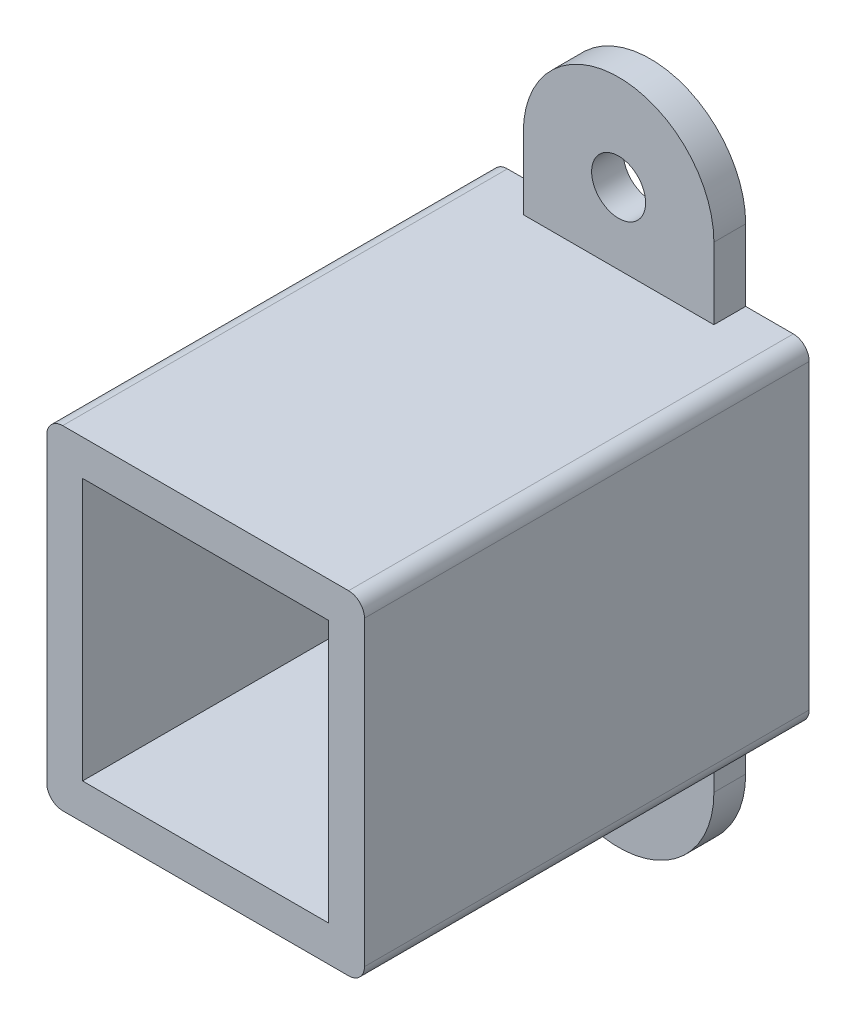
SolidWorks part; units mm, degrees
ref_plane "Front Plane" through (0, 0, 0) normal (0, 0, 1) x (1, 0, 0)
ref_plane "Top Plane" through (0, 0, 0) normal (0, 1, 0) x (1, 0, 0)
ref_plane "Right Plane" through (0, 0, 0) normal (1, 0, 0) x (0, 0, -1)
sketch "Sketch1" plane through (0, 0, 0) normal (0, 0, 1) x (1, 0, 0)
  line L1 (-7.75, -8.25) -> (7.75, -8.25)
  line L2 (-7.75, -8.25) -> (-7.75, 8.25)
  line L3 (-7.75, 8.25) -> (7.75, 8.25)
  line L4 (7.75, -8.25) -> (7.75, 8.25)
  line L5 (-7.75, -8.25) -> (7.75, 8.25) construction
  line L6 (-7.75, 8.25) -> (7.75, -8.25) construction
  line L7 (-10, -10.5) -> (10, -10.5)
  line L8 (-10, -10.5) -> (-10, 10.5)
  line L9 (-10, 10.5) -> (10, 10.5)
  line L10 (10, -10.5) -> (10, 10.5)
  line L11 (-10, -10.5) -> (10, 10.5) construction
  line L12 (-10, 10.5) -> (10, -10.5) construction
  point P0 (0, 0)
  point P6 (0, 0)
  dimension "D1" = 15.5
  dimension "D2" = 16.5
  dimension "D3" = 21
  dimension "D4" = 20
extrude "Boss-Extrude2" add sketch "Sketch1" along normal blind 28
sketch "Sketch2" plane through (0, 0, 0) normal (0, 0, -1) x (-1, 0, 0)
  line L0 (-6, 10.5) -> (-6, 15)
  line L1 (-10, -10.5) -> (-6, -10.5)
  line L2 (-10, -10.5) -> (-10, 10.5)
  line L3 (-10, 10.5) -> (-6, 10.5)
  line L4 (10, -10.5) -> (10, 10.5)
  line L5 (-10, -10.5) -> (10, 10.5) construction
  line L6 (-10, 10.5) -> (10, -10.5) construction
  line L7 (0, -15) -> (0, 15) construction
  line L8 (-6, -15) -> (-6, -10.5)
  line L9 (6, -15) -> (6, -10.5)
  line L10 (6, -10.5) -> (10, -10.5)
  line L11 (6, 10.5) -> (10, 10.5)
  line L12 (6, 10.5) -> (6, 15)
  arc A0 (-6, -15) -> (6, -15) centre (0, -15) ccw
  arc A1 (6, 15) -> (-6, 15) centre (0, 15) ccw
  point P0 (0, 0)
  point P11 (0, 0)
  dimension "D3" = 6
  dimension "D1" = 15
  dimension "D2" = 30
extrude "Boss-Extrude3" add sketch "Sketch2" against normal blind 2
hole_wizard "M3 Clearance Hole1" positions "Sketch4" profile "Sketch3" hole size "M3" standard "ANSI Metric"
sketch "Sketch4" plane through (0, 0, 2) normal (0, 0, 1) x (1, 0, 0)
  line L0 (0, 21) -> (0, -21) construction
  arc A0 (6, 15) -> (-6, 15) centre (0, 15) ccw construction
  arc A1 (-6, -15) -> (6, -15) centre (0, -15) ccw construction
  point P0 (0, 15)
  point P2 (0, -15)
  dimension "D1" = 15
  dimension "D2" = 15
sketch "Sketch3" plane through (0, 15, 2) normal (1, 0, 0) x (0, -1, 0)
  line L0 (0, 0) -> (0, 2)
  line L1 (0, 2) -> (1.7, 2)
  line L2 (1.7, 2) -> (1.7, 0)
  line L5 (1.7, 0) -> (0, 0)
  line L11 (0, -6.35) -> (0, 107.95) construction
  dimension "Thru Hole Dia." = 3.4
  dimension "Thru Hole Depth" = 2
fillet "Fillet1" radius 1 4 edges at (10, 10.5, 14) (10, -10.5, 14) (-10, -10.5, 14) (-10, 10.5, 14)
